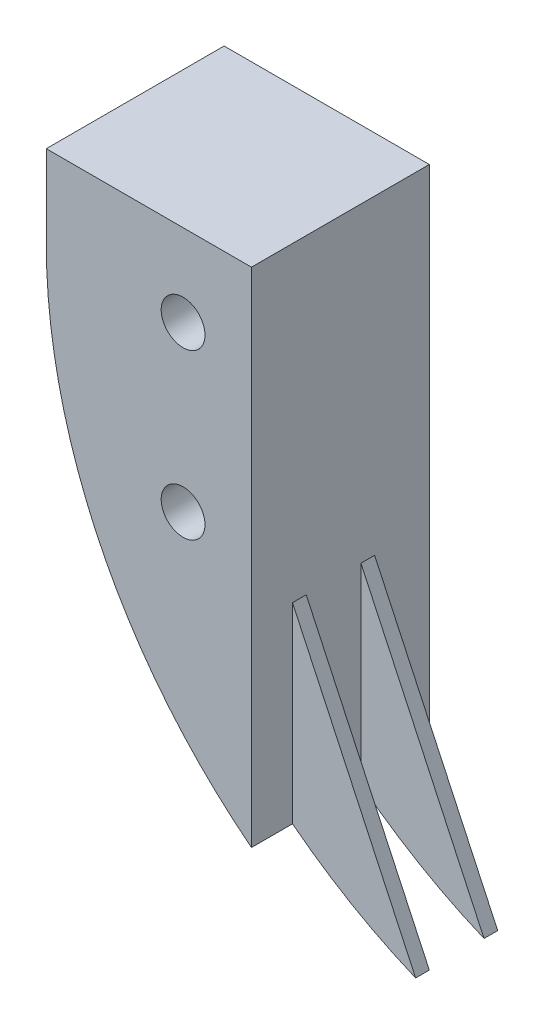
SolidWorks part; units mm, degrees
ref_plane "Plan de face" through (0, 0, 0) normal (0, 0, 1) x (1, 0, 0)
ref_plane "Plan de dessus" through (0, 0, 0) normal (0, 1, 0) x (1, 0, 0)
ref_plane "Plan de droite" through (0, 0, 0) normal (1, 0, 0) x (0, 0, -1)
sketch "Esquisse1" plane through (0, 0, 0) normal (0, 0, 1) x (1, 0, 0)
  line L0 (15.5, 71) -> (15.5, 68) construction
  line L1 (23, 71) -> (15.5, 71) construction
  line L2 (15.5, 71) -> (15.5, 68)
  line L3 (23, 71) -> (15.5, 71)
  line L4 (23, 71) -> (23, 52.6296)
  arc A0 (15.5, 68) -> (27.1473, 50.1511) centre (35, 68) ccw construction
  arc A1 (15.5, 68) -> (23, 52.6296) centre (35, 68) ccw
extrude "Boss.-Extru.1" add sketch "Esquisse1" along normal up to surface (6.5 mm away)
ref_plane "Plan1" through (0, 0, 5) normal (0, 0, 1) x (1, 0, 0)
sketch "Esquisse2" plane through (0, 0, 5) normal (0, 0, 1) x (1, 0, 0)
  line L0 (23, 59.6296) -> (23, 52.6296)
  line L1 (23, 52.6296) -> (23, 71) construction
  line L2 (23, 59.6296) -> (27.5, 50)
  arc A0 (15.5, 68) -> (27.1473, 50.1511) centre (35, 68) ccw construction
  arc A1 (23, 52.6296) -> (27.5, 50) centre (35, 68) ccw
  dimension "D1" = 4.5
  dimension "D2" = 7
extrude "Boss.-Extru.2" add sketch "Esquisse2" against normal blind 0.5
pattern_linear "Répétition linéaire1" count 2 spacing 2.5 along (0, 0, -1) of "Boss.-Extru.2"
hole_wizard "Trou taraudé M21" positions "Esquisse4" profile "Esquisse3" tap size "M2" standard "Iso"
sketch "Esquisse4" plane through (0, 0, 6.5) normal (0, 0, 1) x (1, 0, 0)
  circle A0 centre (20.5, 68) radius 1.2 construction
  circle A1 centre (20.5, 62) radius 1.2 construction
  point P0 (20.5, 68)
  point P2 (20.5, 62)
sketch "Esquisse3" plane through (20.5, 68, 6.5) normal (1, 0, 0) x (0, -1, 0)
  line L0 (0, 0) -> (0, 4.4807)
  line L1 (0, 4.4807) -> (0.8, 4)
  line L2 (0.8, 4) -> (0.8, 0)
  line L5 (0.8, 0) -> (0, 0)
  line L10 (0, 4.4807) -> (-0.8, 4) construction
  line L11 (0, -6.35) -> (0, 107.95) construction
  dimension "Diamètre du trou pour taraudage" = 1.6
  dimension "Profondeur du trou pour taraudage" = 4
  dimension "Angle de pointe" = 118
